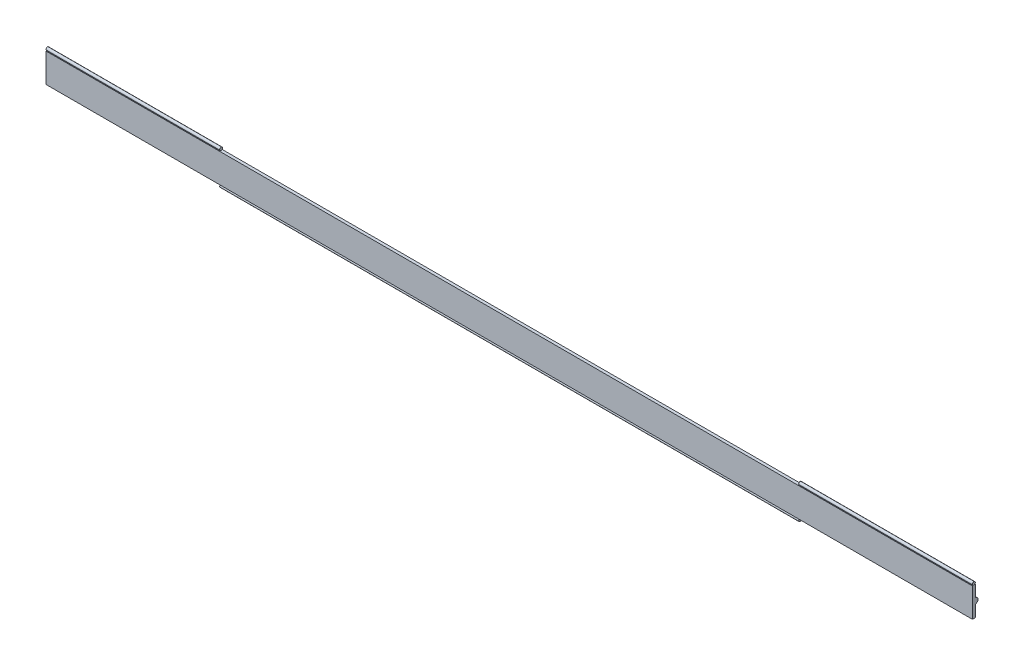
SolidWorks part; units mm, degrees
ref_plane "Front Plane" through (0, 0, 0) normal (0, 0, 1) x (1, 0, 0)
ref_plane "Top Plane" through (0, 0, 0) normal (0, 1, 0) x (1, 0, 0)
ref_plane "Right Plane" through (0, 0, 0) normal (1, 0, 0) x (0, 0, -1)
sketch "Sketch1" plane through (0, 0, 0) normal (0, 0, 1) x (1, 0, 0)
  line L1 (0, 0) -> (812.8, 0)
  line L2 (0, 0) -> (0, 25.4)
  line L3 (0, 25.4) -> (812.8, 25.4)
  line L4 (812.8, 0) -> (812.8, 25.4)
  dimension "D1" = 812.8
  dimension "D2" = 25.4
extrude "Boss-Extrude1" add sketch "Sketch1" along normal blind 2.54
sketch "Sketch2" plane through (812.8, 0, 0) normal (1, 0, 0) x (0, 0, -1)
  line L1 (-2.54, 0) -> (0, 0) construction
  line L2 (-1.27, 0) -> (-1.27, -1.27) construction
  circle A1 centre (-1.27, -1.27) radius 1.27
  dimension "D2" = 2.54
  dimension "D3" = 1.27
extrude "Boss-Extrude3" add sketch "Sketch2" against normal up to vertex (812.8 mm away) separate body contours A1
sketch "Sketch3" plane through (812.8, 0, 0) normal (1, 0, 0) x (0, 0, -1)
  line L0 (-1.27, 25.4) -> (-1.27, 26.67) construction
  line L1 (-2.54, 25.4) -> (0, 25.4) construction
  circle A0 centre (-1.27, 26.67) radius 1.27
  dimension "D1" = 2.54
  dimension "D2" = 1.27
extrude "Boss-Extrude4" add sketch "Sketch3" against normal up to vertex (812.8 mm away) separate body
sketch "Sketch4" plane through (0, 0, 0) normal (0, 0, 1) x (1, 0, 0)
  line L0 (812.8, 33.7044) -> (812.8, -8.9454) construction
  line L1 (660.4, 33.7044) -> (660.4, -8.9454) construction
  line L2 (406.4, 33.7044) -> (406.4, -8.9454) construction
  line L3 (0, 33.7044) -> (0, -8.9454) construction
  line L4 (152.4, 33.7044) -> (152.4, -8.9454) construction
  line L5 (-8.7869, 0) -> (152.4, 0)
  line L6 (812.8, 0) -> (0, 0) construction
  line L7 (152.4, 0) -> (152.4, -18.3832)
  line L8 (152.4, -18.3832) -> (660.4, -18.3832)
  line L9 (660.4, -18.3832) -> (660.4, 0)
  line L10 (0, 0) -> (812.8, 0) construction
  line L11 (660.4, 0) -> (812.8, 0)
  line L12 (812.8, 0) -> (812.8, -18.3832)
  line L13 (812.8, -18.3832) -> (857.1545, -18.3832)
  line L14 (857.1545, -18.3832) -> (857.1545, 44.471)
  line L15 (857.1545, 44.471) -> (660.4, 44.471)
  line L16 (660.4, 44.471) -> (660.4, 25.4)
  line L17 (0, 25.4) -> (812.8, 25.4) construction
  line L18 (660.4, 25.4) -> (152.4, 25.4)
  line L19 (812.8, 25.4) -> (0, 25.4) construction
  line L20 (152.4, 25.4) -> (152.4, 51.7073)
  line L21 (152.4, 51.7073) -> (0, 51.7073)
  line L22 (0, 51.7073) -> (-8.7869, 51.7073)
  line L23 (-8.7869, 51.7073) -> (-8.7869, 0)
  line L24 (-59.5869, 102.5073) -> (-59.5869, -50.8)
  line L25 (-59.5869, -50.8) -> (101.6, -50.8)
  line L26 (101.6, -50.8) -> (101.6, -69.1832)
  line L27 (101.6, -69.1832) -> (711.2, -69.1832)
  line L28 (711.2, -69.1832) -> (711.2, -50.8)
  line L29 (711.2, -50.8) -> (762, -50.8)
  line L30 (762, -50.8) -> (762, -69.1832)
  line L31 (762, -69.1832) -> (907.9545, -69.1832)
  line L32 (907.9545, -69.1832) -> (907.9545, 95.271)
  line L33 (907.9545, 95.271) -> (609.6, 95.271)
  line L34 (609.6, 95.271) -> (609.6, 76.2)
  line L35 (609.6, 76.2) -> (203.2, 76.2)
  line L36 (203.2, 76.2) -> (203.2, 102.5073)
  line L37 (203.2, 102.5073) -> (0, 102.5073)
  line L38 (0, 102.5073) -> (-59.5869, 102.5073)
  dimension "D1" = 254
  dimension "D2" = 406.4
  dimension "D3" = 254
  dimension "D4" = 50.8
extrude "Cut-Extrude2" cut sketch "Sketch4" against normal blind 50.8 and the other way blind 2.54
sketch "Sketch5" plane through (0, 0, 0) normal (1, 0, 0) x (0, 0, -1)
  line L0 (0, 15.0658) -> (0, 10.3342)
  line L1 (0, 25.4) -> (0, 0) construction
  line L2 (0, 12.7) -> (-2.54, 12.7) construction
  line L3 (-2.54, 25.4) -> (-2.54, 0) construction
  arc A0 (0, 15.0658) -> (0, 10.3342) centre (0, 12.7) cw
extrude "Boss-Extrude5" add sketch "Sketch5" along normal up to vertex (812.8 mm away)
